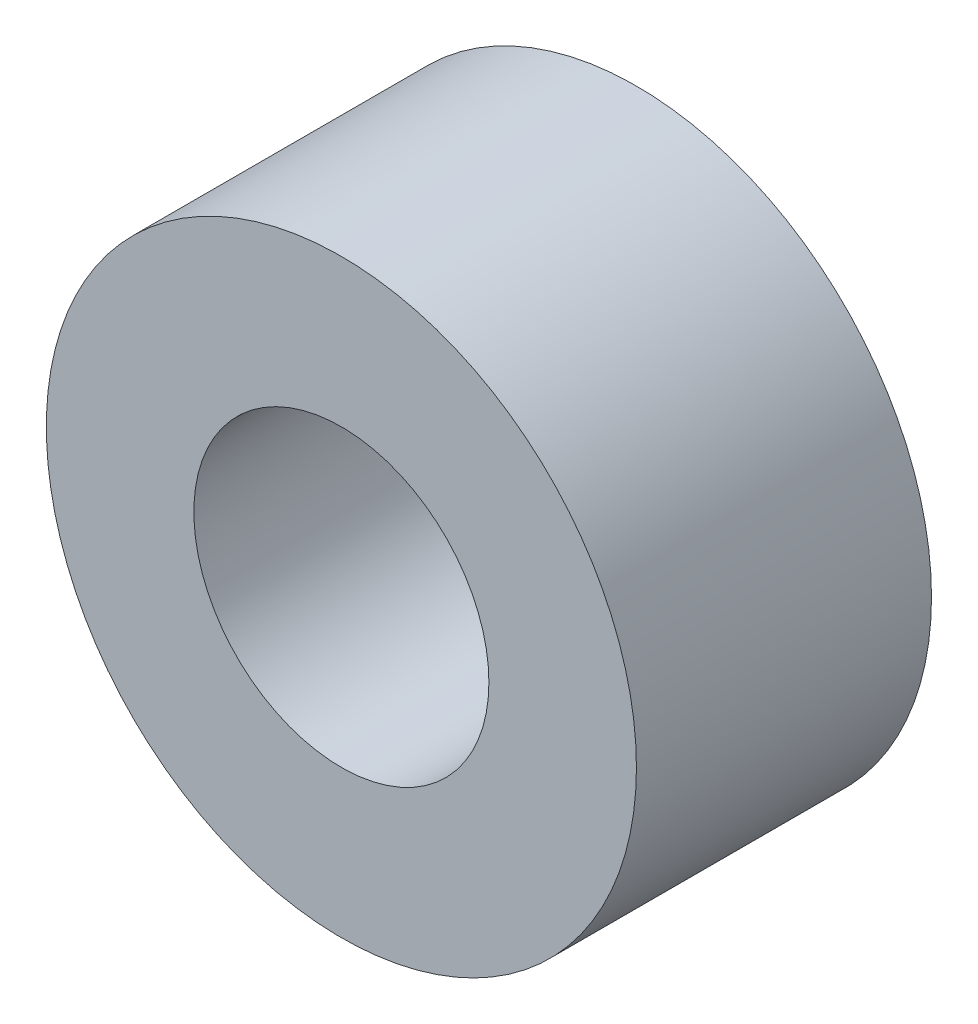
SolidWorks part; units mm, degrees
ref_plane "Front Plane" through (0, 0, 0) normal (0, 0, 1) x (1, 0, 0)
ref_plane "Top Plane" through (0, 0, 0) normal (0, 1, 0) x (1, 0, 0)
ref_plane "Right Plane" through (0, 0, 0) normal (1, 0, 0) x (0, 0, -1)
sketch "Sketch1" plane through (0, 0, 0) normal (0, 0, 1) x (1, 0, 0)
  circle A0 centre (0, 0) radius 3.175
  circle A1 centre (0, 0) radius 1.5875
  dimension "D1" = 3.175
  dimension "D2" = 6.35
extrude "Boss-Extrude1" add sketch "Sketch1" along normal blind 3.175
